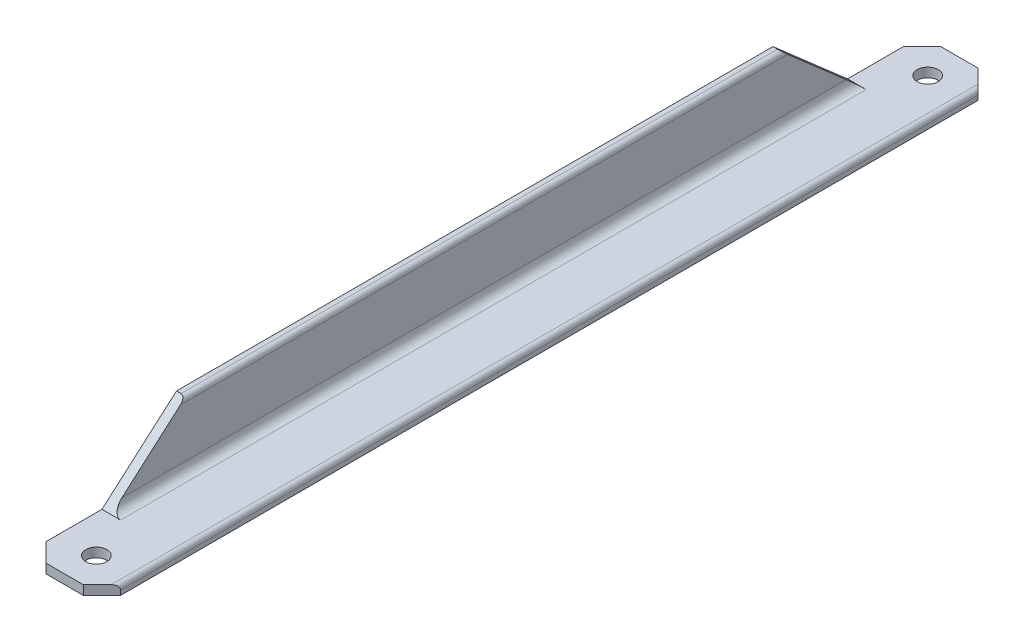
SolidWorks part; units mm, degrees
ref_plane "Front" through (0, 0, 0) normal (0, 0, 1) x (1, 0, 0)
ref_plane "Top" through (0, 0, 0) normal (0, 1, 0) x (1, 0, 0)
ref_plane "Right" through (0, 0, 0) normal (1, 0, 0) x (0, 0, -1)
sketch "Sketch1" plane through (0, 0, 0) normal (0, 0, 1) x (1, 0, 0)
  line L0 (0, 0) -> (0, 50.8)
  line L1 (0, 0) -> (50.8, 0)
  line L2 (12.7, 6.35) -> (47.625, 6.35)
  line L3 (6.35, 12.7) -> (6.35, 47.625)
  line L4 (6.35, 6.35) -> (50.8, 6.35) construction
  line L5 (6.35, 6.35) -> (6.35, 50.8) construction
  line L6 (50.8, 3.175) -> (50.8, 0)
  line L7 (3.175, 50.8) -> (0, 50.8)
  arc A0 (12.7, 6.35) -> (6.35, 12.7) centre (12.7, 12.7) cw
  arc A1 (50.8, 3.175) -> (47.625, 6.35) centre (47.625, 3.175) ccw
  arc A2 (6.35, 47.625) -> (3.175, 50.8) centre (3.175, 47.625) ccw
  dimension "D4" = 6.35
  dimension "D5" = 3.175
  dimension "D1" = 50.8
  dimension "D2" = 50.8
  dimension "D3" = 6.35
extrude "Boss-Extrude1" add sketch "Sketch1" along normal mid plane 609.6
sketch "Sketch2" plane through (6.35, 0, 0) normal (1, 0, 0) x (0, 0, -1)
  line L0 (-304.8, 6.35) -> (-254, 6.35)
  line L1 (-304.8, 6.35) -> (304.8, 6.35) construction
  line L2 (-254, 6.35) -> (-203.2, 50.8)
  line L3 (-304.8, 50.8) -> (304.8, 50.8) construction
  line L4 (-203.2, 50.8) -> (-304.8, 50.8)
  line L5 (-304.8, 50.8) -> (-304.8, 6.35)
  line L6 (0, 0) -> (0, 54.4197) construction
  line L7 (304.8, 50.8) -> (304.8, 6.35)
  line L8 (203.2, 50.8) -> (304.8, 50.8)
  line L9 (254, 6.35) -> (203.2, 50.8)
  line L10 (304.8, 6.35) -> (254, 6.35)
  dimension "D1" = 50.8
  dimension "D2" = 101.6
extrude "Cut-Extrude1" cut sketch "Sketch2" against normal through all both and the other way through all
sketch "Sketch3" plane through (0, 6.35, 0) normal (0, 1, 0) x (1, 0, 0)
  line L0 (0, 304.8) -> (12.7, 304.8)
  line L1 (47.625, 304.8) -> (0, 304.8) construction
  line L2 (12.7, 304.8) -> (0, 292.1)
  line L3 (0, 254) -> (0, 304.8) construction
  line L4 (0, 292.1) -> (0, 304.8)
  line L5 (50.8, 304.8) -> (38.1, 304.8)
  line L6 (38.1, 304.8) -> (50.8, 292.1)
  line L7 (50.8, -304.8) -> (50.8, 304.8) construction
  line L8 (50.8, 292.1) -> (50.8, 304.8)
  line L9 (0, 0) -> (29.7885, 0) construction
  line L10 (50.8, -292.1) -> (50.8, -304.8)
  line L11 (38.1, -304.8) -> (50.8, -292.1)
  line L12 (50.8, -304.8) -> (38.1, -304.8)
  line L13 (0, -292.1) -> (0, -304.8)
  line L14 (12.7, -304.8) -> (0, -292.1)
  line L15 (0, -304.8) -> (12.7, -304.8)
  dimension "D1" = 12.7
  dimension "D2" = 12.7
  dimension "D3" = 12.7
  dimension "D4" = 12.7
extrude "Cut-Extrude2" cut sketch "Sketch3" against normal through all both and the other way through all
sketch "Sketch4" plane through (0, 6.35, 0) normal (0, 1, 0) x (1, 0, 0)
  line L0 (38.1, 304.8) -> (12.7, 304.8) construction
  line L1 (0, 0) -> (65.4872, 0) construction
  circle A0 centre (25.4, 283.21) radius 7.1374
  circle A1 centre (25.4, -283.21) radius 7.1374
  point P4 (25.4, 304.8)
  dimension "D1" = 14.2748
  dimension "D2" = 21.59
extrude "Cut-Extrude3" cut sketch "Sketch4" against normal through all both and the other way through all
